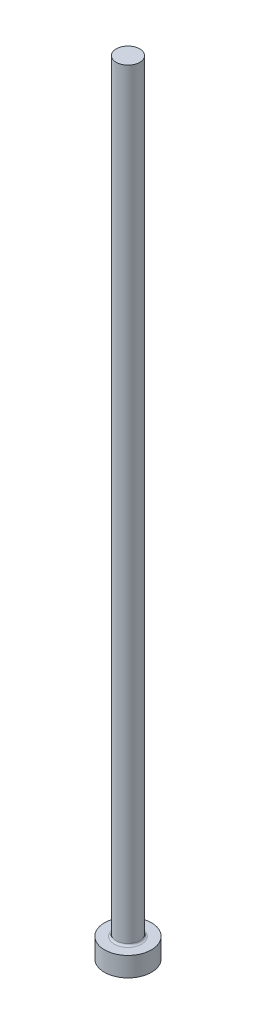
SolidWorks part; units mm, degrees
ref_plane "Plano frontal" through (0, 0, 0) normal (0, 0, 1) x (1, 0, 0)
ref_plane "Plano superior" through (0, 0, 0) normal (0, 1, 0) x (1, 0, 0)
ref_plane "Plano direito" through (0, 0, 0) normal (1, 0, 0) x (0, 0, -1)
sketch "Esboço1" plane through (0, 0, 0) normal (0, 0, 1) x (1, 0, 0)
  line L0 (0, 0) -> (6, 0)
  line L1 (6, 0) -> (6, 5)
  line L2 (6, 5) -> (3.5, 5)
  line L3 (3, 5.5) -> (3, 200)
  line L4 (3, 200) -> (0, 200)
  line L5 (0, 200) -> (0, 0) construction
  line L6 (0, 0) -> (0, 200)
  arc A0 (3.5, 5) -> (3, 5.5) centre (3.5, 5.5) cw
  dimension "D3" = 0.5
  dimension "D1" = 12
  dimension "D2" = 6
  dimension "D4" = 5
  dimension "D5" = 200
revolve "Revolução1" add sketch "Esboço1" angle 360 about L5
sketch "Esboço2"
  dimension "D1" = 3.225
  dimension "D2" = 1.05
  dimension "D3" = 0.675
  dimension "D4" = 0.45
wrap "Envolver1" sketch "Esboço2" wrap type deboss source sketch "Esboço2" thickness 0.1 parameters "D1"=0.1
